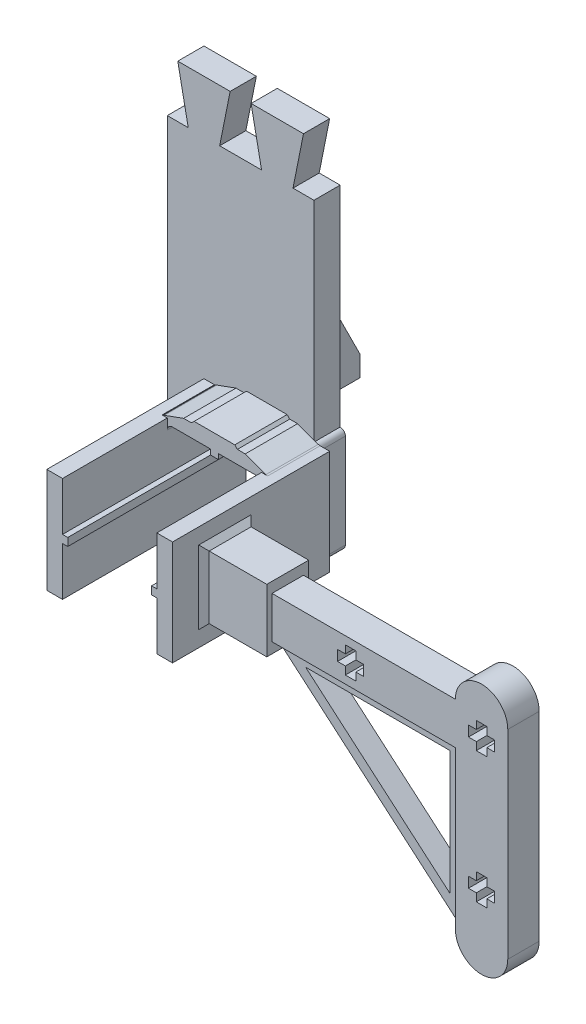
SolidWorks part; units mm, degrees
ref_plane "前视基准面" through (0, 0, 0) normal (0, 0, 1) x (1, 0, 0)
ref_plane "上视基准面" through (0, 0, 0) normal (0, 1, 0) x (1, 0, 0)
ref_plane "右视基准面" through (0, 0, 0) normal (1, 0, 0) x (0, 0, -1)
sketch "草图1" plane through (0, 0, 0) normal (0, 0, 1) x (1, 0, 0)
  line L0 (10, 10) -> (-10, 10)
  line L1 (9, 9) -> (-9, 9)
  line L2 (9, 9) -> (9, -9)
  line L3 (9, -9) -> (-9, -9)
  line L4 (-9, 9) -> (-9, -9)
  line L5 (9, 9) -> (-9, -9) construction
  line L6 (9, -9) -> (-9, 9) construction
  line L7 (-10, 10) -> (-10, -10)
  line L8 (10, -10) -> (-10, -10)
  line L9 (10, 10) -> (10, -10)
  line L10 (-10, 10) -> (-11.5, 5.8788)
  line L11 (-11.5, 5.8788) -> (-11.5, 4.3788)
  line L12 (-11.5, 4.3788) -> (-12, 3.8788)
  line L13 (-12, 3.8788) -> (-12, -3.8788)
  line L14 (-12, 0) -> (0, 0) construction
  line L15 (-11.5, -4.3788) -> (-12, -3.8788)
  line L16 (-11.5, -5.8788) -> (-11.5, -4.3788)
  line L17 (-10, -10) -> (-11.5, -5.8788)
  line L18 (10, 10) -> (5.8788, 11.5)
  line L19 (5.8788, 11.5) -> (4.3788, 11.5)
  line L20 (4.3788, 11.5) -> (3.8788, 12)
  line L21 (3.8788, 12) -> (-3.8788, 12)
  line L22 (-4.3788, 11.5) -> (-3.8788, 12)
  line L23 (-5.8788, 11.5) -> (-4.3788, 11.5)
  line L24 (-10, 10) -> (-5.8788, 11.5)
  line L25 (10, -10) -> (11.5, -5.8788)
  line L26 (11.5, -5.8788) -> (11.5, -4.3788)
  line L27 (11.5, -4.3788) -> (12, -3.8788)
  line L28 (12, -3.8788) -> (12, 3.8788)
  line L29 (11.5, 4.3788) -> (12, 3.8788)
  line L30 (11.5, 5.8788) -> (11.5, 4.3788)
  line L31 (10, 10) -> (11.5, 5.8788)
  line L32 (-10, -10) -> (-5.8788, -11.5)
  line L33 (-5.8788, -11.5) -> (-4.3788, -11.5)
  line L34 (-4.3788, -11.5) -> (-3.8788, -12)
  line L35 (-3.8788, -12) -> (3.8788, -12)
  line L36 (4.3788, -11.5) -> (3.8788, -12)
  line L37 (5.8788, -11.5) -> (4.3788, -11.5)
  line L38 (10, -10) -> (5.8788, -11.5)
  point P0 (0, 0)
  point P45 (0, 0)
  dimension "D1" = 18
  dimension "D2" = 18
  dimension "D4" = 1.5
  dimension "D5" = 0.5
  dimension "D6" = 20
  dimension "D7" = 135
  dimension "D8" = 1.5
  dimension "D3" = 1
  dimension "D9" = 4
extrude "凸台-拉伸1" add sketch "草图1" along normal blind 10 contours L38 L8 L32 L33 L34 L35 L36 L37 | L9 L0 L7 L8 L4 L1 L2 L3 | L17 L7 L10 L11 L12 L13 L15 L16 | L24 L0 L18 L19 L20 L21 L22 L23
fillet "圆角1" radius 1 4 edges at (-9, -9, 5) (9, -9, 5) (9, 9, 5) (-9, 9, 5)
sketch "草图3" plane through (0, 0, 10) normal (0, 0, 1) x (1, 0, 0)
  line L0 (10, 10) -> (12, 10)
  line L1 (12, 10) -> (12, -10)
  line L2 (12, -10) -> (10, -10)
  line L3 (10, -10) -> (10, 10)
  dimension "D1" = 2
extrude "凸台-拉伸2" add sketch "草图3" against normal up to surface (10 mm away)
sketch "草图4" plane through (0, 0, 10) normal (0, 0, 1) x (1, 0, 0)
  line L0 (10, 10) -> (9, 10)
  line L1 (12, 10) -> (10, 10)
  line L2 (12, 10) -> (12, -10)
  line L3 (12, -10) -> (9, -10)
  line L5 (9, 10) -> (9, -10)
  dimension "D1" = 2
  dimension "D2" = 1
extrude "凸台-拉伸3" add sketch "草图4" along normal blind 20
fillet "圆角3" radius 1 4 edges at (10, -10, 5) (10, 10, 5) (-10, -10, 5) (-10, 10, 5)
sketch "草图5" plane through (0, 0, 10) normal (0, 0, 1) x (1, 0, 0)
  line L0 (8, 9) -> (-8, 9) construction
  line L1 (0.75, 10) -> (-0.75, 10)
  line L2 (0.75, 10) -> (0.75, 8)
  line L3 (0.75, 8) -> (-0.75, 8)
  line L4 (-0.75, 10) -> (-0.75, 8)
  line L5 (0.75, 10) -> (-0.75, 8) construction
  line L6 (0.75, 8) -> (-0.75, 10) construction
  line L7 (8, -0.75) -> (8, 0.75)
  line L8 (10, 0.75) -> (8, 0.75)
  line L9 (10, -0.75) -> (8, -0.75)
  line L10 (10, -0.75) -> (10, 0.75)
  line L11 (-0.75, -8) -> (0.75, -8)
  line L12 (0.75, -10) -> (0.75, -8)
  line L13 (-0.75, -10) -> (-0.75, -8)
  line L14 (-0.75, -10) -> (0.75, -10)
  line L15 (-8, 0.75) -> (-8, -0.75)
  line L16 (-10, -0.75) -> (-8, -0.75)
  line L17 (-10, 0.75) -> (-8, 0.75)
  line L18 (-10, 0.75) -> (-10, -0.75)
  point P0 (0, 9)
  point P22 (0, 0)
  dimension "D1" = 1.5
  dimension "D2" = 2
  dimension "D3" = 4
extrude "凸台-拉伸4" add sketch "草图5" against normal up to surface (10 mm away)
ref_plane "基准面1" through (0, 0, 20) normal (0, 0, 1) x (1, 0, 0)
sketch "草图6" plane through (0, 0, 20) normal (0, 0, 1) x (1, 0, 0)
  line L0 (12, -10) -> (12, 10) construction
  line L1 (24, 6) -> (12, 6)
  line L2 (24, 6) -> (24, -6)
  line L3 (24, -6) -> (12, -6)
  line L4 (12, 6) -> (12, -6)
  line L5 (24, 6) -> (12, -6) construction
  line L6 (24, -6) -> (12, 6) construction
  line L7 (0, 0) -> (18, 0) construction
  point P0 (18, 0)
  dimension "D1" = 12
  dimension "D2" = 12
extrude "凸台-拉伸5" add sketch "草图6" along normal mid plane 8
sketch "草图7" plane through (24, 0, 0) normal (1, 0, 0) x (0, 0, -1)
  line L0 (-20, 1.1) -> (-20, -1.1) construction
  line L1 (-17, 4) -> (-23, 4)
  line L2 (-17, 4) -> (-17, -4)
  line L3 (-17, -4) -> (-23, -4)
  line L4 (-23, 4) -> (-23, -4)
  line L5 (-17, 4) -> (-23, -4) construction
  line L6 (-17, -4) -> (-23, 4) construction
  line L7 (-20, 6) -> (-20, 0) construction
  line L8 (-24, 6) -> (-16, 6) construction
  point P0 (-20, 0)
  dimension "D1" = 6
  dimension "D2" = 8
  dimension "D3" = 6
extrude "凸台-拉伸6" add sketch "草图7" along normal blind 35
sketch "草图8" plane through (0, 0, 20) normal (0, 0, 1) x (1, 0, 0)
  line L0 (64, 4) -> (64, -34) construction
  line L1 (69, 4) -> (69, -34)
  line L2 (59, 4) -> (59, -34)
  line L3 (59, 4) -> (64, 4) construction
  line L4 (59, 4) -> (59, -4) construction
  arc A0 (69, 4) -> (59, 4) centre (64, 4) ccw
  arc A1 (59, -34) -> (69, -34) centre (64, -34) ccw
  point P2 (64, -15)
  dimension "D1" = 5
  dimension "D2" = 38
extrude "凸台-拉伸7" add sketch "草图8" along normal mid plane 6
sketch "草图11" plane through (0, 0, 20) normal (0, 0, 1) x (1, 0, 0)
  line L0 (24, -4) -> (59, -34)
  line L1 (59, -4) -> (24, -4) construction
  line L2 (24, -6) -> (24, 6) construction
rib "筋1" sketch "草图11" sketch "草图11" thickness 4 extrusion direction parallel to sketch draft on no parameters "D1"=4
sketch "草图12" plane through (0, 0, 22) normal (0, 0, 1) x (1, 0, 0)
  line L0 (29.4065, -6) -> (57, -29.6516)
  line L1 (57, -29.6516) -> (57, -6)
  line L2 (57, -6) -> (29.4065, -6)
  line L3 (59, -4) -> (24, -4)
  line L4 (24, -4) -> (59, -34)
  line L5 (59, -34) -> (59, -4)
  line L6 (59, -4) -> (24, -4)
  line L7 (24, -4) -> (59, -34)
  line L8 (59, -34) -> (59, -4)
  dimension "D1" = 0
  dimension "D2" = 2
extrude "切除-拉伸1" cut sketch "草图12" against normal through all contours L0 L1 L2
chamfer "倒角1" distance 1 angle 45 4 edges at (12, -6, 20) (12, 0, 16) (12, 6, 20) (12, 0, 24)
sketch "草图13" plane through (0, 0, 23) normal (0, 0, 1) x (1, 0, 0)
  line L0 (64, 9) -> (64, -39) construction
  line L2 (66.5, 2.5) -> (61.5, 2.5)
  line L3 (66.5, 2.5) -> (66.5, -2.5)
  line L4 (66.5, -2.5) -> (61.5, -2.5)
  line L5 (61.5, 2.5) -> (61.5, -2.5)
  line L6 (66.5, 2.5) -> (61.5, -2.5) construction
  line L7 (66.5, -2.5) -> (61.5, 2.5) construction
  line L8 (63, 2.5) -> (63, 1)
  line L9 (63, 1) -> (61.5, 1)
  line L10 (61.5, -1) -> (63, -1)
  line L11 (63, -1) -> (63, -2.5)
  line L12 (65, 2.5) -> (65, 1)
  line L13 (65, 1) -> (66.5, 1)
  line L14 (66.5, -1) -> (65, -1)
  line L15 (65, -1) -> (65, -2.5)
  arc A0 (69, 4) -> (59, 4) centre (64, 4) ccw construction
  arc A1 (59, -34) -> (69, -34) centre (64, -34) ccw construction
  point P8 (64, 0)
  dimension "D1" = 5
  dimension "D2" = 5
  dimension "D3" = 1.5
  dimension "D4" = 1.5
  dimension "D5" = 1.5
  dimension "D6" = 1.5
  dimension "D7" = 1.5
  dimension "D8" = 1.5
  dimension "D9" = 1.5
  dimension "D10" = 9
extrude "切除-拉伸2" cut sketch "草图13" against normal blind 6 contours L15 L14 L3 L13 L12 L2 L8 L9 L5 L10 L11 L4
pattern_linear "阵列(线性)1" count 2 spacing 25 along (0, -1, 0) of "切除-拉伸2"
pattern_linear "阵列(线性)2" count 2 spacing 25 along (-1, 0, 0) of "切除-拉伸2"
sketch "草图14" plane through (0, 0, 0) normal (0, 0, -1) x (-1, 0, 0)
  line L0 (-9, -0.75) -> (-9, -8) construction
  line L1 (8, 9) -> (-8, 9)
  line L2 (9, 8) -> (9, -8)
  line L3 (8, -9) -> (-8, -9)
  line L4 (-9, 8) -> (-9, -8)
  line L5 (9, 9) -> (-9, -9) construction
  line L6 (9, -9) -> (-9, 9) construction
  line L8 (9, 10) -> (-9, 10)
  line L9 (10, 9) -> (10, -9)
  line L10 (9, -10) -> (-9, -10)
  line L11 (-10, 9) -> (-10, -9)
  line L12 (10, 10) -> (-10, -10) construction
  line L13 (10, -10) -> (-10, 10) construction
  line L14 (0.75, 10) -> (-0.75, 10)
  line L15 (0.75, 10) -> (0.75, 8)
  line L16 (0.75, 8) -> (-0.75, 8)
  line L17 (-0.75, 10) -> (-0.75, 8)
  line L18 (0.75, 10) -> (-0.75, 8) construction
  line L19 (0.75, 8) -> (-0.75, 10) construction
  line L20 (-10, -0.75) -> (-8, -0.75)
  line L21 (-10, -0.75) -> (-10, 0.75)
  line L22 (-10, 0.75) -> (-8, 0.75)
  line L23 (-8, -0.75) -> (-8, 0.75)
  line L24 (-10, -0.75) -> (-8, 0.75) construction
  line L25 (-10, 0.75) -> (-8, -0.75) construction
  line L26 (0.75, -10) -> (-0.75, -10)
  line L27 (0.75, -10) -> (0.75, -8)
  line L28 (0.75, -8) -> (-0.75, -8)
  line L29 (-0.75, -10) -> (-0.75, -8)
  line L30 (0.75, -10) -> (-0.75, -8) construction
  line L31 (0.75, -8) -> (-0.75, -10) construction
  line L32 (10, 0.75) -> (8, 0.75)
  line L33 (10, 0.75) -> (10, -0.75)
  line L34 (10, -0.75) -> (8, -0.75)
  line L35 (8, 0.75) -> (8, -0.75)
  line L36 (10, 0.75) -> (8, -0.75) construction
  line L37 (10, -0.75) -> (8, 0.75) construction
  arc A0 (-9, 10) -> (-10, 9) centre (-9, 9) ccw
  arc A1 (10, -9) -> (9, -10) centre (9, -9) cw
  arc A2 (9, 10) -> (10, 9) centre (9, 9) cw
  arc A3 (-9, -10) -> (-10, -9) centre (-9, -9) cw
  arc A4 (-8, 9) -> (-9, 8) centre (-8, 8) ccw
  arc A5 (9, -8) -> (8, -9) centre (8, -8) cw
  arc A6 (8, 9) -> (9, 8) centre (8, 8) cw
  arc A7 (-8, -9) -> (-9, -8) centre (-8, -8) cw
  point P0 (0, 0)
  point P8 (0, 0)
  point P37 (0, 9)
  point P43 (-9, 0)
  point P49 (0, -9)
  point P55 (9, 0)
  dimension "D4" = 1
  dimension "D1" = 20
  dimension "D2" = 20
  dimension "D3" = 18
ref_plane "基准面2" through (-12, -3.8788, 0) normal (0, -1, 0) x (-1, 0, 0)
extrude "凸台-拉伸10" add sketch "草图14" along normal blind 5 contours L1 A6 L2 L32 L9 A2 L8 L15 | L34 L9 L32 L2 | L32 L35 L34 L2 | L2 A5 L3 L27 L10 A1 L9 L34 | L29 L10 L27 L3 | L29 L3 L27 L28 | L3 A7 L4 L20 L11 A3 L10 L29 | L20 L23 L22 L4 | L22 L11 L20 L4 | A4 L1 L17 L8 A0 L11 L22 L4 | L8 L17 L1 L15 | L1 L17 L16 L15
sketch "草图17" plane through (0, 10, 0) normal (0, 1, 0) x (1, 0, 0)
  line L1 (-9, 5) -> (9, 5)
  line L2 (-9, 5) -> (-9, 0)
  line L3 (-9, 0) -> (9, 0)
  line L4 (9, 5) -> (9, 0)
extrude "凸台-拉伸11" add sketch "草图17" along normal blind 50
ref_plane "基准面3" through (-9, 10, 0) normal (-1, 0, 0) x (0, 0, 1)
sketch "草图20" plane through (0, 0, -5) normal (0, 0, -1) x (-1, 0, 0)
  line L0 (9, 60) -> (9, 10) construction
  line L1 (9, 60) -> (9, 10)
  line L2 (10, 9) -> (10, -9) construction
  line L3 (10, 9) -> (10, -9)
  line L4 (9, 60) -> (19, 60)
  line L5 (19, 60) -> (19, -9)
  line L6 (19, -9) -> (10, -9)
  arc A0 (10, 9) -> (9, 10) centre (9, 9) ccw construction
  arc A1 (10, 9) -> (9, 10) centre (9, 9) ccw
  dimension "D1" = 10
extrude "凸台-拉伸12" add sketch "草图20" against normal up to surface (5 mm away)
sketch "草图21" plane through (0, 0, -5) normal (0, 0, -1) x (-1, 0, 0)
  line L0 (19, -9) -> (19, 60) construction
  line L1 (-9, 60) -> (19, 60)
  line L2 (-9, 60) -> (-9, 50)
  line L3 (-9, 50) -> (19, 50)
  line L4 (19, 60) -> (19, 50)
  line L5 (-5, 50) -> (-7, 60)
  line L6 (1, 50) -> (3, 60)
  line L7 (5, 60) -> (5, 50) construction
  line L8 (9, 50) -> (7, 60)
  line L9 (15, 50) -> (17, 60)
  dimension "D1" = 10
  dimension "D2" = 2
  dimension "D3" = 2
  dimension "D4" = 6
  dimension "D5" = 4
extrude "切除-拉伸3" cut sketch "草图21" against normal blind 38 contours L3 L5 L1 M12 | L7 L6 L3 M11 | L1 L7 L3 L8 | L9 L3 M10 M11
sketch "草图22" plane through (0, 0, 10) normal (0, 0, 1) x (1, 0, 0)
  line L4 (8, -0.75) -> (9, -0.75)
  line L6 (8, -0.75) -> (9, -0.75)
  line L12 (9, -0.75) -> (9, 0.75)
  line L13 (9, -0.75) -> (9, 0.75)
  line L14 (9, 0.75) -> (8, 0.75)
  line L15 (9, 0.75) -> (8, 0.75)
  line L16 (8, 0.75) -> (8, -0.75)
  line L17 (8, 0.75) -> (8, -0.75)
  dimension "D1" = 0
extrude "凸台-拉伸13" add sketch "草图22" along normal up to surface (20 mm away)
sketch "草图23" plane through (-0.75, 0, 0) normal (-1, 0, 0) x (0, 0, 1)
  line L0 (-5, 8) -> (-17, 8)
  line L1 (-17, 8) -> (-17, 12)
  line L3 (-5, 50) -> (-5, 10) construction
  line L4 (-5, 24) -> (-5, 8)
  line L5 (-17, 12) -> (-11, 24)
  line L6 (-11, 24) -> (-5, 24)
  dimension "D1" = 4
  dimension "D2" = 12
  dimension "D3" = 6
  dimension "D4" = 16
extrude "凸台-拉伸16" add sketch "草图23" against normal blind 1.5
mirror "镜向1" about plane through (0, 0, 0) normal (1, 0, 0) of "凸台-拉伸3", "凸台-拉伸2"
sketch "草图24" plane through (0, 0, 10) normal (0, 0, 1) x (1, 0, 0)
  line L4 (-9, 0.75) -> (-9, -0.75)
  line L5 (-9, -0.75) -> (-8, -0.75)
  line L6 (-8, -0.75) -> (-8, 0.75)
  line L7 (-8, 0.75) -> (-9, 0.75)
  line L8 (-9, 0.75) -> (-9, -0.75)
  line L9 (-9, -0.75) -> (-8, -0.75)
  line L10 (-8, -0.75) -> (-8, 0.75)
  line L11 (-8, 0.75) -> (-9, 0.75)
  dimension "D1" = 0
extrude "凸台-拉伸17" add sketch "草图24" along normal up to surface (20 mm away)
